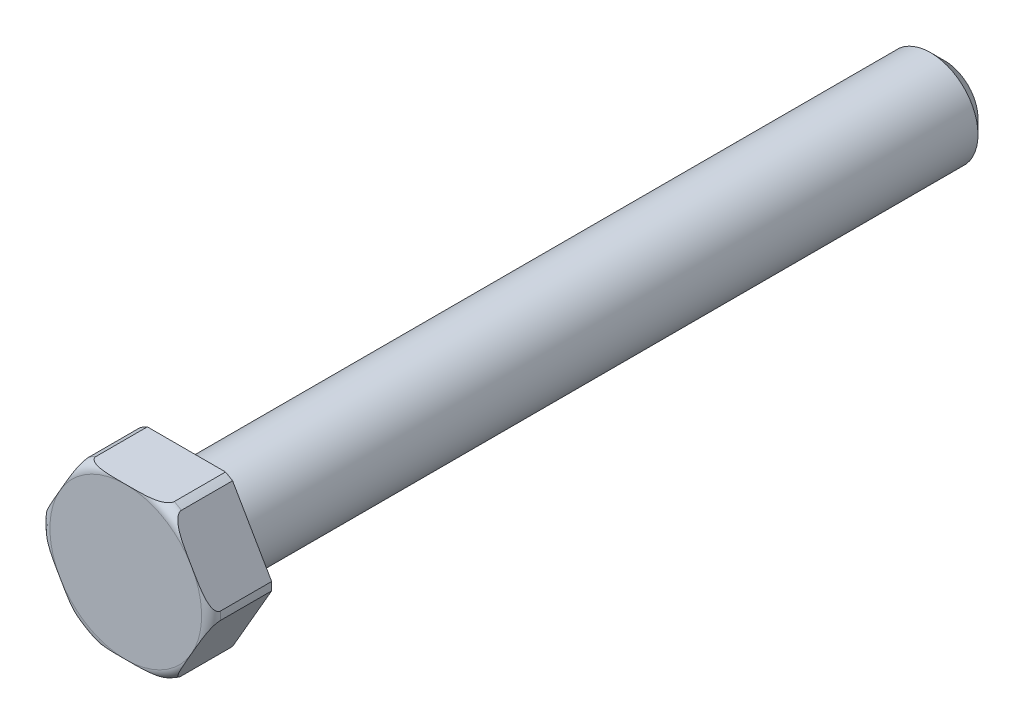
SolidWorks part; units mm, degrees
ref_plane "Plan1" through (0, 0, 0) normal (0, 0, 1) x (1, 0, 0)
ref_plane "Plan2" through (0, 0, 0) normal (0, 1, 0) x (1, 0, 0)
ref_plane "Plan3" through (0, 0, 0) normal (1, 0, 0) x (0, 0, -1)
sketch "Esquisse1" plane through (0, 0, 0) normal (0, 0, 1) x (1, 0, 0)
  circle A0 centre (0, 0) radius 9
  dimension "D1" = 18
extrude "Extrusion1" add sketch "Esquisse1" along normal blind 6.4
fillet "Congé1" radius 1
sketch "Esquisse2" plane through (0, 0, 6.4) normal (0, 0, 1) x (1, 0, 0)
  line L1 (9.2376, 0) -> (4.6188, 8)
  line L2 (4.6188, 8) -> (-4.6188, 8)
  line L3 (-4.6188, 8) -> (-9.2376, 0)
  line L4 (-9.2376, 0) -> (-4.6188, -8)
  line L5 (-4.6188, -8) -> (4.6188, -8)
  line L6 (4.6188, -8) -> (9.2376, 0)
  circle A0 centre (0, 0) radius 8 construction
  circle A1 centre (0, 0) radius 14.1421
  dimension "D1" = 16
extrude "Enlèv. mat.-Extru.1" cut sketch "Esquisse2" against normal through all
sketch "Esquisse3" plane through (0, 0, 0) normal (0, 0, -1) x (-1, 0, 0)
  circle A0 centre (0, 0) radius 5
  dimension "D1" = 10
extrude "Extrusion2" add sketch "Esquisse3" along normal blind 80
chamfer "Chanfrein1" distance 1.5 angle 45
